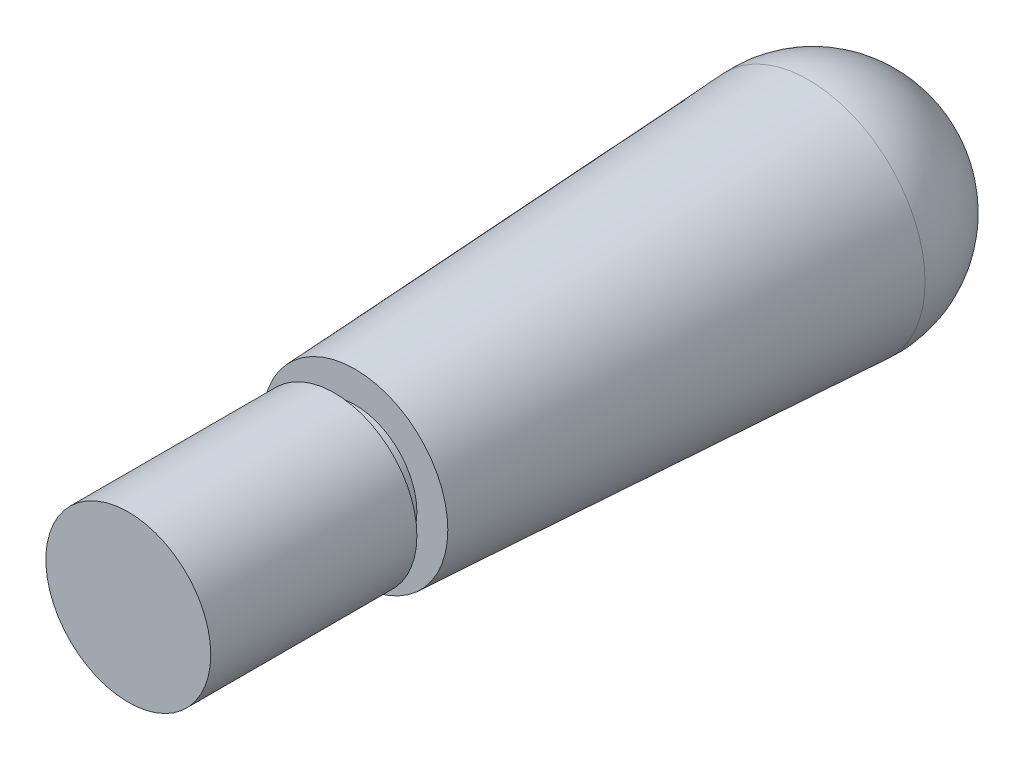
SolidWorks part; units mm, degrees
ref_plane "Front Plane" through (0, 0, 0) normal (0, 0, 1) x (1, 0, 0)
ref_plane "Top Plane" through (0, 0, 0) normal (0, 1, 0) x (1, 0, 0)
ref_plane "Right Plane" through (0, 0, 0) normal (1, 0, 0) x (0, 0, -1)
sketch "Sketch1" plane through (0, 0, 0) normal (1, 0, 0) x (0, 0, -1)
  line L0 (0, 0) -> (1146.1129, 0) construction
  line L1 (0, 101.6) -> (254, 101.6)
  line L2 (254, 101.6) -> (254, 76.2)
  line L3 (254, 76.2) -> (279.4, 76.2)
  line L4 (279.4, 76.2) -> (279.4, 114.3)
  line L5 (279.4, 114.3) -> (838.2, 143.5855)
  line L6 (0, 101.6) -> (0, 0)
  line L7 (0, 0) -> (985.1518, 0)
  arc A0 (838.2, 143.5855) -> (985.1518, 0) centre (845.5113, 4.0769) cw
  point P14 (266.7, 76.2)
  dimension "D6" = 139.7
  dimension "D1" = 203.2
  dimension "D2" = 254
  dimension "D3" = 228.6
  dimension "D4" = 25.4
  dimension "D5" = 3
  dimension "D7" = 558.8
  dimension "D8" = 152.4
revolve "Revolve1" add sketch "Sketch1" angle 360 about L0
